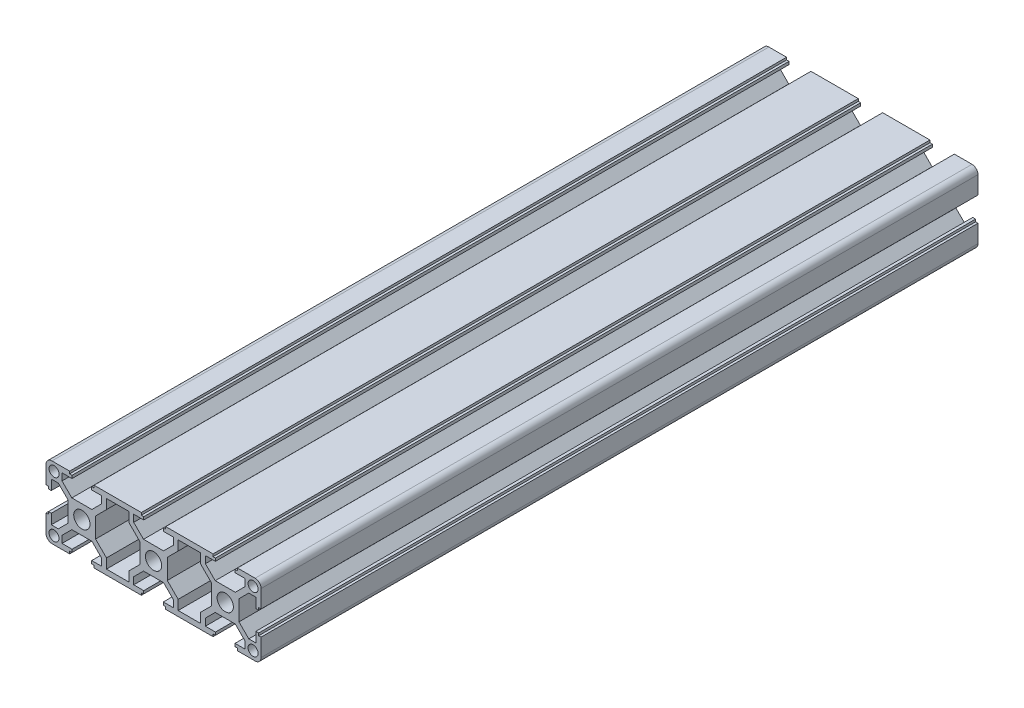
SolidWorks part; units mm, degrees
ref_plane "前视基准面" through (0, 0, 0) normal (0, 0, 1) x (1, 0, 0)
ref_plane "上视基准面" through (0, 0, 0) normal (0, 1, 0) x (1, 0, 0)
ref_plane "右视基准面" through (0, 0, 0) normal (1, 0, 0) x (0, 0, -1)
sketch "草图1" plane through (0, 0, 0) normal (0, 0, 1) x (1, 0, 0)
  line B0 (25.9, -12.8) -> (21.7, -12.8)
  line B1 (21.7, -12.8) -> (21.7, -9.8556)
  line B2 (25.9, -14) -> (25.9, -12.8)
  line B3 (21.7, -9.8556) -> (25.8056, -5.75)
  line B4 (24.9, -14) -> (25.9, -14)
  line B5 (30, -5.75) -> (25.8056, -5.75)
  line B6 (24.9, -15) -> (24.9, -14)
  line B7 (30, -5.75) -> (34.1944, -5.75)
  line B8 (-5.1, -15) -> (-24.9, -15)
  line B9 (38.3, -9.8556) -> (34.1944, -5.75)
  line B10 (-24.9, -15) -> (-24.9, -14)
  line B11 (38.3, -12.8) -> (38.3, -9.8556)
  line B12 (-24.9, -14) -> (-25.9, -14)
  line B13 (34.1, -12.8) -> (38.3, -12.8)
  line B14 (-25.9, -14) -> (-25.9, -12.8)
  line B15 (34.1, -14) -> (34.1, -12.8)
  line B16 (-21.7, -12.8) -> (-25.9, -12.8)
  line B17 (35.1, -14) -> (34.1, -14)
  line B18 (-21.7, -12.8) -> (-21.7, -9.8556)
  line B19 (35.1, -15) -> (35.1, -14)
  line B20 (-21.7, -9.8556) -> (-25.8056, -5.75)
  line B21 (42.5, -15) -> (35.1, -15)
  line B22 (-30, -5.75) -> (-25.8056, -5.75)
  line B23 (-30, -5.75) -> (-34.1944, -5.75)
  line B24 (45, -12.5) -> (45, -5.1)
  line B25 (-38.3, -9.8556) -> (-34.1944, -5.75)
  line B26 (45, -5.1) -> (44, -5.1)
  line B27 (-38.3, -12.8) -> (-38.3, -9.8556)
  line B28 (44, -5.1) -> (44, -4.1)
  line B29 (-34.1, -12.8) -> (-38.3, -12.8)
  line B30 (44, -4.1) -> (42.8, -4.1)
  line B31 (-34.1, -14) -> (-34.1, -12.8)
  line B32 (42.8, -4.1) -> (42.8, -8.3)
  line B33 (-35.1, -14) -> (-34.1, -14)
  line B34 (42.8, -8.3) -> (39.8556, -8.3)
  line B35 (-35.1, -15) -> (-35.1, -14)
  line B36 (39.8556, -8.3) -> (35.75, -4.1944)
  line B37 (-42.5, -15) -> (-35.1, -15)
  line B38 (35.75, 0) -> (35.75, -4.1944)
  line B39 (35.75, 0) -> (35.75, 4.1944)
  line B40 (-45, -12.5) -> (-45, -5.1)
  line B41 (39.8556, 8.3) -> (35.75, 4.1944)
  line B42 (-45, -5.1) -> (-44, -5.1)
  line B43 (42.8, 8.3) -> (39.8556, 8.3)
  line B44 (-44, -5.1) -> (-44, -4.1)
  line B45 (42.8, 4.1) -> (42.8, 8.3)
  line B46 (-44, -4.1) -> (-42.8, -4.1)
  line B47 (44, 4.1) -> (42.8, 4.1)
  line B48 (-42.8, -4.1) -> (-42.8, -8.3)
  line B49 (44, 5.1) -> (44, 4.1)
  line B50 (-42.8, -8.3) -> (-39.8556, -8.3)
  line B51 (45, 5.1) -> (44, 5.1)
  line B52 (-39.8556, -8.3) -> (-35.75, -4.1944)
  line B53 (45, 12.5) -> (45, 5.1)
  line B54 (-35.75, 0) -> (-35.75, -4.1944)
  line B55 (-35.75, 0) -> (-35.75, 4.1944)
  line B56 (42.5, 15) -> (35.1, 15)
  line B57 (-39.8556, 8.3) -> (-35.75, 4.1944)
  line B58 (35.1, 15) -> (35.1, 14)
  line B59 (-42.8, 8.3) -> (-39.8556, 8.3)
  line B60 (35.1, 14) -> (34.1, 14)
  line B61 (-42.8, 4.1) -> (-42.8, 8.3)
  line B62 (34.1, 14) -> (34.1, 12.8)
  line B63 (-44, 4.1) -> (-42.8, 4.1)
  line B64 (34.1, 12.8) -> (38.3, 12.8)
  line B65 (-44, 5.1) -> (-44, 4.1)
  line B66 (38.3, 12.8) -> (38.3, 9.8556)
  line B67 (-45, 5.1) -> (-44, 5.1)
  line B68 (38.3, 9.8556) -> (34.1944, 5.75)
  line B69 (-45, 12.5) -> (-45, 5.1)
  line B70 (30, 5.75) -> (34.1944, 5.75)
  line B71 (30, 5.75) -> (25.8056, 5.75)
  line B72 (-42.5, 15) -> (-35.1, 15)
  line B73 (21.7, 9.8556) -> (25.8056, 5.75)
  line B74 (-35.1, 15) -> (-35.1, 14)
  line B75 (21.7, 12.8) -> (21.7, 9.8556)
  line B76 (-35.1, 14) -> (-34.1, 14)
  line B77 (25.9, 12.8) -> (21.7, 12.8)
  line B78 (-34.1, 14) -> (-34.1, 12.8)
  line B79 (25.9, 14) -> (25.9, 12.8)
  line B80 (-34.1, 12.8) -> (-38.3, 12.8)
  line B81 (24.9, 14) -> (25.9, 14)
  line B82 (-38.3, 12.8) -> (-38.3, 9.8556)
  line B83 (24.9, 15) -> (24.9, 14)
  line B84 (-38.3, 9.8556) -> (-34.1944, 5.75)
  line B85 (-30, 5.75) -> (-34.1944, 5.75)
  line B86 (-24.9, 15) -> (-24.9, 14)
  line B87 (-30, 5.75) -> (-25.8056, 5.75)
  line B88 (-24.9, 14) -> (-25.9, 14)
  line B89 (-21.7, 9.8556) -> (-25.8056, 5.75)
  line B90 (-25.9, 14) -> (-25.9, 12.8)
  line B91 (-21.7, 12.8) -> (-21.7, 9.8556)
  line B92 (-25.9, 12.8) -> (-21.7, 12.8)
  line B93 (19.7, -8.7444) -> (19.7, -12.8)
  line B94 (19.7, -8.7444) -> (24.25, -4.1944)
  line B95 (24.25, 0) -> (24.25, -4.1944)
  line B96 (-19.7, -8.7444) -> (-19.7, -12.8)
  line B97 (24.25, 0) -> (24.25, 4.1944)
  line B98 (-24.25, -4.1944) -> (-19.7, -8.7444)
  line B99 (19.7, 8.7444) -> (24.25, 4.1944)
  line B100 (-24.25, 0) -> (-24.25, -4.1944)
  line B101 (19.7, 12.8) -> (19.7, 8.7444)
  line B102 (-24.25, 0) -> (-24.25, 4.1944)
  line B103 (-24.25, 4.1944) -> (-19.7, 8.7444)
  line B104 (-19.7, 12.8) -> (-19.7, 8.7444)
  line B105 (4.1, -12.8) -> (8.3, -12.8)
  line B106 (8.3, -12.8) -> (8.3, -9.8556)
  line B107 (4.1, -14) -> (4.1, -12.8)
  line B108 (8.3, -9.8556) -> (4.1944, -5.75)
  line B109 (5.1, -14) -> (4.1, -14)
  line B110 (0, -5.75) -> (4.1944, -5.75)
  line B111 (5.1, -15) -> (5.1, -14)
  line B112 (0, -5.75) -> (-4.1944, -5.75)
  line B113 (5.1, -15) -> (24.9, -15)
  line B114 (-8.3, -9.8556) -> (-4.1944, -5.75)
  line B115 (-8.3, -12.8) -> (-8.3, -9.8556)
  line B116 (-4.1, -12.8) -> (-8.3, -12.8)
  line B117 (-4.1, -14) -> (-4.1, -12.8)
  line B118 (-5.1, -14) -> (-4.1, -14)
  line B119 (-5.1, -15) -> (-5.1, -14)
  line B120 (-5.75, 0) -> (-5.75, -4.1944)
  line B121 (-5.75, 0) -> (-5.75, 4.1944)
  line B122 (-5.1, 15) -> (-5.1, 14)
  line B123 (-5.1, 14) -> (-4.1, 14)
  line B124 (-4.1, 14) -> (-4.1, 12.8)
  line B125 (-4.1, 12.8) -> (-8.3, 12.8)
  line B126 (-8.3, 12.8) -> (-8.3, 9.8556)
  line B127 (-8.3, 9.8556) -> (-4.1944, 5.75)
  line B128 (0, 5.75) -> (-4.1944, 5.75)
  line B129 (0, 5.75) -> (4.1944, 5.75)
  line B130 (8.3, 9.8556) -> (4.1944, 5.75)
  line B131 (8.3, 12.8) -> (8.3, 9.8556)
  line B132 (4.1, 12.8) -> (8.3, 12.8)
  line B133 (4.1, 14) -> (4.1, 12.8)
  line B134 (5.1, 14) -> (4.1, 14)
  line B135 (5.1, 15) -> (5.1, 14)
  line B136 (24.9, 15) -> (5.1, 15)
  line B137 (10.3, -8.7444) -> (10.3, -12.8)
  line B138 (10.3, -8.7444) -> (5.75, -4.1944)
  line B139 (19.7, -12.8) -> (10.3, -12.8)
  line B140 (5.75, 0) -> (5.75, -4.1944)
  line B141 (5.75, 0) -> (5.75, 4.1944)
  line B142 (10.3, 8.7444) -> (5.75, 4.1944)
  line B143 (10.3, 12.8) -> (10.3, 8.7444)
  line B144 (19.7, 12.8) -> (10.3, 12.8)
  line B145 (-10.3, 8.7444) -> (-5.75, 4.1944)
  line B146 (-10.3, -8.7444) -> (-5.75, -4.1944)
  line B147 (-24.25, 4.1944) -> (-24.25, -4.1944)
  line B148 (-10.3, 12.8) -> (-10.3, 8.7444)
  line B149 (-10.3, -8.7444) -> (-10.3, -12.8)
  line B150 (-10.3, -12.8) -> (-19.7, -12.8)
  line B151 (-10.3, 12.8) -> (-19.7, 12.8)
  line B152 (-24.9, 15) -> (-5.1, 15)
  arc B153 (-30, -3.4) -> (-26.6, 0) centre (-30, 0) ccw
  arc B154 (-26.6, 0) -> (-30, 3.4) centre (-30, 0) ccw
  arc B155 (-33.4, 0) -> (-30, -3.4) centre (-30, 0) ccw
  arc B156 (-30, 3.4) -> (-33.4, 0) centre (-30, 0) ccw
  arc B157 (30, 3.4) -> (26.6, 0) centre (30, 0) ccw
  arc B158 (26.6, 0) -> (30, -3.4) centre (30, 0) ccw
  arc B159 (33.4, 0) -> (30, 3.4) centre (30, 0) ccw
  arc B160 (30, -3.4) -> (33.4, 0) centre (30, 0) ccw
  arc B161 (42.5, -15) -> (45, -12.5) centre (42.5, -12.5) ccw
  arc B162 (-45, -12.5) -> (-42.5, -15) centre (-42.5, -12.5) ccw
  arc B163 (45, 12.5) -> (42.5, 15) centre (42.5, 12.5) ccw
  arc B164 (-42.5, 15) -> (-45, 12.5) centre (-42.5, 12.5) ccw
  circle B165 centre (41.65, 11.65) radius 2.1
  circle B166 centre (-41.65, 11.65) radius 2.1
  circle B167 centre (-41.65, -11.65) radius 2.1
  circle B168 centre (41.65, -11.65) radius 2.1
  arc B169 (3.4, 0) -> (0, 3.4) centre (0, 0) ccw
  arc B170 (0, 3.4) -> (-3.4, 0) centre (0, 0) ccw
  arc B171 (0, -3.4) -> (3.4, 0) centre (0, 0) ccw
  arc B172 (-3.4, 0) -> (0, -3.4) centre (0, 0) ccw
sketch_block_instance "A$C751F5B93-1"
sketch_block "A$C751F5B93"
extrude "凸台-拉伸1" add sketch "草图1" along normal mid plane 300 contours B72 B164 B69 B67 B65 B63 B61 B59 B57 B55 B54 B52 B50 B48 B46 B44 B42 B40 B162 B37 B35 B33 B31 B29 B27 B25 B23 B22 B20 B18 B16 B14 B12 B10 B8 B119 B118 B117 B116 B115 B114 B112 B110 B108 B106 B105 B107 B109 B111 B113 B6
